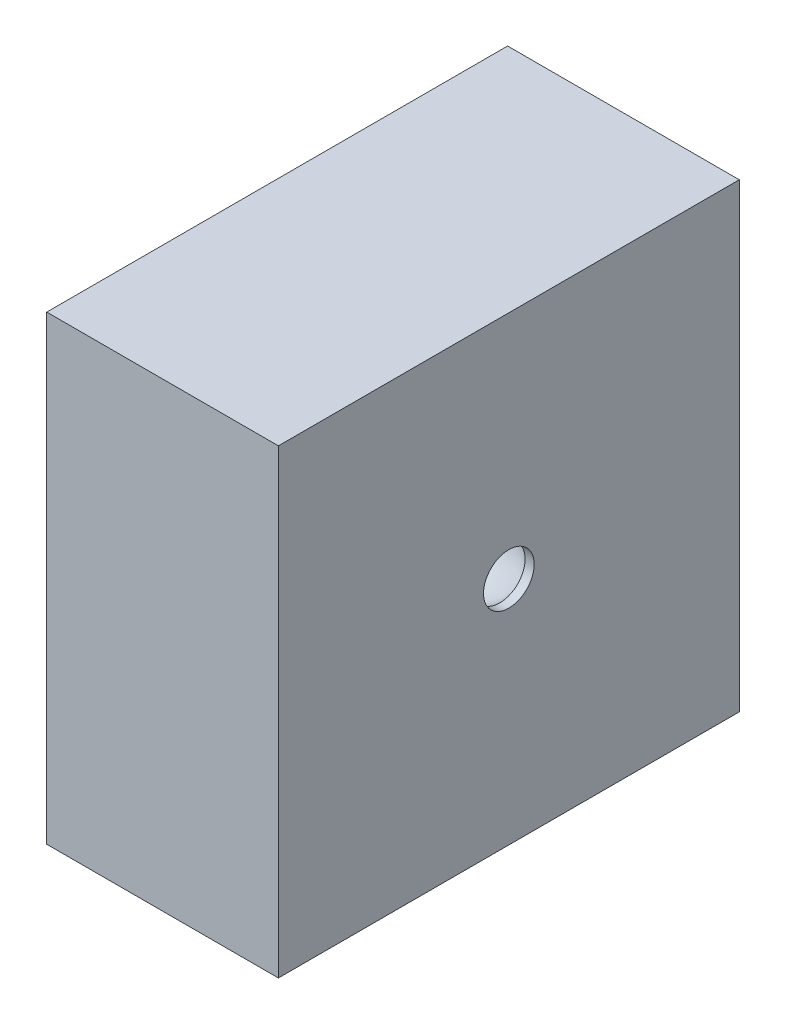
SolidWorks part; units mm, degrees
ref_plane "Front Plane" through (0, 0, 0) normal (0, 0, 1) x (1, 0, 0)
ref_plane "Top Plane" through (0, 0, 0) normal (0, 1, 0) x (1, 0, 0)
ref_plane "Right Plane" through (0, 0, 0) normal (1, 0, 0) x (0, 0, -1)
sketch "Sketch1" plane through (0, 0, 0) normal (0, 1, 0) x (1, 0, 0)
  line L1 (0, 5.5601) -> (0, 2.794)
  line L2 (0, 2.794) -> (-1, 2.794)
  line L3 (-6.4864, 5.5601) -> (-6.4864, 4.6335)
  line L4 (0, 0) -> (-7.7416, 0) construction
  line L5 (-6.4864, 5.5601) -> (0, 5.5601)
  arc A1 (-1, 2.794) -> (-6.4864, 4.6335) centre (-6.6446, -4.9399) ccw
  dimension "D1" = 2.794
revolve "Revolve1" add sketch "Sketch1" angle 360 about L4
sketch "Sketch2" plane through (0, 0, 0) normal (1, 0, 0) x (0, 0, -1)
  line L1 (-25.4, -25.4) -> (25.4, -25.4)
  line L2 (-25.4, -25.4) -> (-25.4, 25.4)
  line L3 (-25.4, 25.4) -> (25.4, 25.4)
  line L4 (25.4, -25.4) -> (25.4, 25.4)
  line L5 (-25.4, -25.4) -> (25.4, 25.4) construction
  line L6 (-25.4, 25.4) -> (25.4, -25.4) construction
  circle A0 centre (0, 0) radius 5.5601
  point P0 (0, 0)
  dimension "D1" = 50.8
  dimension "D2" = 50.8
extrude "Boss-Extrude1" add sketch "Sketch2" against normal up to surface (6.4864 mm away)
sketch "Sketch3" plane through (0, 0, 0) normal (0, 0, 1) x (1, 0, 0)
  line L0 (-25.5364, 4.8927) -> (-6.4864, 4.6335)
  line L1 (-6.4864, 4.6355) -> (-31.8864, 4.9784) construction
  line L2 (-6.4864, 0) -> (-29.5982, 0) construction
  line L3 (-6.4864, 25.4) -> (-6.4864, -25.4) construction
  line L4 (-6.4864, 6.5807) -> (-25.5364, 6.5807)
  line L5 (-25.5364, 4.8927) -> (-25.5364, 6.5807)
  line L6 (-6.4864, 4.6335) -> (-6.4864, 6.5807)
  dimension "D1" = 1.9472
  dimension "D2" = 19.05
revolve "Revolve2" add sketch "Sketch3" angle 360 about L2
sketch "Sketch5" plane through (-6.4864, 0, 0) normal (-1, 0, 0) x (0, 0, 1)
  line L1 (-25.4, -25.4) -> (25.4, -25.4)
  line L2 (-25.4, -25.4) -> (-25.4, 25.4)
  line L3 (-25.4, 25.4) -> (25.4, 25.4)
  line L4 (25.4, -25.4) -> (25.4, 25.4)
  line L5 (-25.4, -25.4) -> (25.4, 25.4) construction
  line L6 (-25.4, 25.4) -> (25.4, -25.4) construction
  circle A0 centre (0, 0) radius 6.5807
  point P0 (0, 0)
extrude "Boss-Extrude2" add sketch "Sketch5" along normal up to surface (19.05 mm away)
